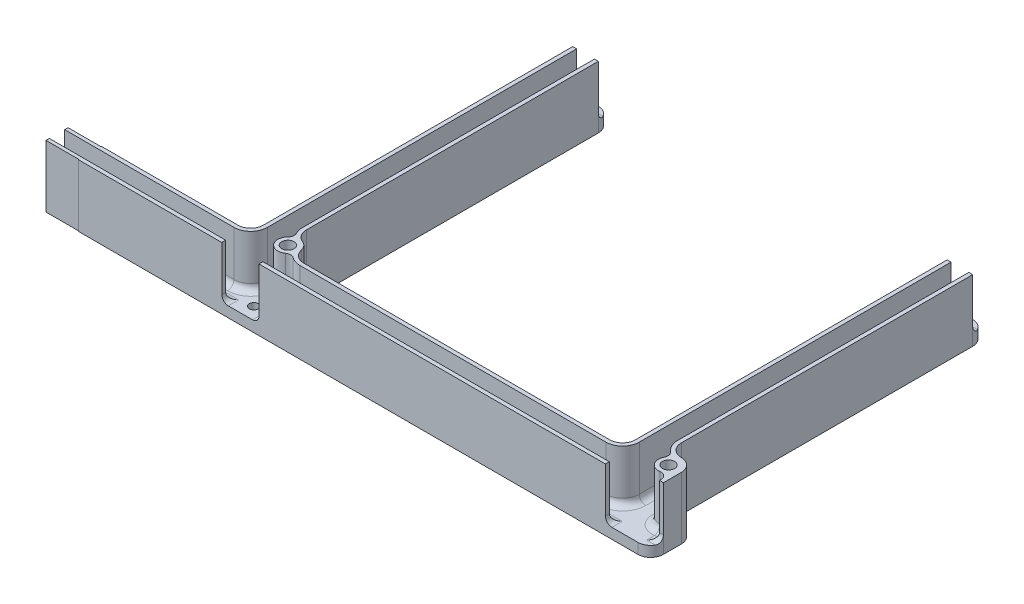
SolidWorks part; units mm, degrees
ref_plane "Front Plane" through (0, 0, 0) normal (0, 0, 1) x (1, 0, 0)
ref_plane "Top Plane" through (0, 0, 0) normal (0, 1, 0) x (1, 0, 0)
ref_plane "Right Plane" through (0, 0, 0) normal (1, 0, 0) x (0, 0, -1)
sketch "Sketch3" plane through (0, 0, 0) normal (0, 1, 0) x (1, 0, 0)
  line L0 (-138.4746, -60.844) -> (-15.34, -60.844)
  line L3 (-147.6746, -69.8669) -> (150.1404, -69.8669)
  line L6 (-152.6746, -64.8669) -> (-152.6746, 65.1331) construction
  line L10 (-157.6746, -64.8669) -> (-157.6746, 66.1101)
  line L13 (-147.6746, -69.8669) -> (-152.6746, -69.8669)
  line L20 (135.1404, -55.844) -> (135.1404, 66.1101)
  line L22 (145.1404, -47.8669) -> (145.1404, 66.1101)
  line L28 (155.1404, -64.8669) -> (155.1404, -57.8669)
  line L30 (-147.58, -49.9437) -> (-147.58, 65.1331)
  line L35 (-0.34, -49.0952) -> (-0.34, 65.1331)
  line L37 (10.4264, -60.844) -> (130.1404, -60.844)
  line L38 (-10.34, -55.844) -> (-10.34, 65.1331)
  arc A4 (150.1404, -69.8669) -> (155.1404, -64.8669) centre (150.1404, -64.8669) ccw
  arc A16 (-157.6746, -64.8669) -> (-152.6746, -69.8669) centre (-152.6746, -64.8669) ccw
  arc A23 (-147.58, 65.1331) -> (-157.6746, 66.1101) centre (-152.6746, 65.1331) ccw
  arc A39 (-0.34, 65.1331) -> (-10.34, 65.1331) centre (-5.34, 65.1331) ccw
  arc A45 (145.1404, 66.1101) -> (135.1404, 66.1101) centre (140.1404, 66.1101) ccw
  arc A46 (150.1404, -69.8669) -> (155.1404, -64.8669) centre (150.1404, -64.8669) ccw
  arc A51 (155.1404, -57.8669) -> (150.1404, -52.8669) centre (150.1404, -57.8669) ccw
  circle A59 centre (150.1404, -57.8669) radius 1.905 construction
  circle A60 centre (1.2264, -57.8669) radius 1.905 construction
  circle A61 centre (-147.6746, -57.8669) radius 1.905 construction
  arc A63 (-143.358, -56.9178) -> (-145.2842, -54.1494) centre (-147.6746, -57.8669) ccw
  arc A64 (5.543, -56.9178) -> (2.8374, -53.7513) centre (1.2264, -57.8669) ccw
  arc A65 (145.1404, -47.8669) -> (150.1404, -52.8669) centre (150.1404, -47.8669) ccw
  arc A66 (135.1404, -55.844) -> (130.1404, -60.844) centre (130.1404, -55.844) cw
  arc A67 (2.8374, -53.7513) -> (-0.34, -49.0952) centre (4.66, -49.0952) cw
  arc A74 (-10.34, -55.844) -> (-15.34, -60.844) centre (-15.34, -55.844) cw
  arc A75 (-147.58, -49.9437) -> (-145.2842, -54.1494) centre (-142.58, -49.9437) ccw
  arc A76 (5.543, -56.9178) -> (10.4264, -60.844) centre (10.4264, -55.844) ccw
  arc A77 (-143.358, -56.9178) -> (-138.4746, -60.844) centre (-138.4746, -55.844) ccw
  circle A78 centre (-147.6746, -57.8669) radius 2.105
  circle A79 centre (1.2264, -57.8669) radius 2.105
  circle A80 centre (150.1404, -57.8669) radius 2.105
  point P15 (-152.6746, 0.6216)
  point P25 (-5.4346, 0.5656)
  point P33 (140.1404, 3.1216)
  point P39 (150.1404, -61.3669)
  dimension "D1" = 5
  dimension "D2" = 5
  dimension "D5" = 5
  dimension "D6" = 5
  dimension "D3" = 5
  dimension "D4" = 130
extrude "Boss-Extrude8" add sketch "Sketch3" along normal blind 24.13 contours A77 A63 A75 L30 A23 L10 A16 L13 L3 A4 L28 A51 A65 L22 A45 L20 A66 L37 A76 A64 A67 L35 A39 L38 A74 L0 A80 A79 A78
sketch "Sketch4" plane through (0, 24.13, 0) normal (0, 1, 0) x (1, 0, 0)
  circle A3 centre (150.1404, -57.8669) radius 2.1082 construction
  circle A4 centre (1.2394, -57.8669) radius 2.0955 construction
  circle A5 centre (-147.6746, -57.8669) radius 2.0955 construction
  circle A6 centre (-147.6746, -57.8669) radius 2.2955
  circle A7 centre (1.2394, -57.8669) radius 2.2955
  circle A8 centre (150.1404, -57.8669) radius 2.3082
  dimension "D1" = 0.2
extrude "Cut-Extrude1" cut sketch "Sketch4" against normal up to next
sketch "Sketch6" plane through (0, 0, 0) normal (0, -1, 0) x (1, 0, 0)
  line L10 (-138.4746, 60.844) -> (-15.34, 60.844)
  line L11 (-10.34, 55.844) -> (-10.34, -65.1331)
  line L12 (-0.34, -65.1331) -> (-0.34, 49.0952)
  line L13 (10.4264, 60.844) -> (130.1404, 60.844)
  line L14 (135.1404, 55.844) -> (135.1404, -66.1101)
  line L15 (145.1404, -66.1101) -> (145.1404, 47.8669)
  line L16 (155.1404, 57.8669) -> (155.1404, 64.8669)
  line L17 (150.1404, 69.8669) -> (-152.6746, 69.8669)
  line L18 (-157.6746, 64.8669) -> (-157.6746, -66.1101)
  line L19 (-147.58, -65.1331) -> (-147.58, 49.9437)
  line L20 (-138.4746, 60.844) -> (-15.34, 60.844)
  line L21 (-10.34, 55.844) -> (-10.34, -65.1331)
  line L22 (-0.34, -65.1331) -> (-0.34, 49.0952)
  line L23 (10.4264, 60.844) -> (130.1404, 60.844)
  line L24 (135.1404, 55.844) -> (135.1404, -66.1101)
  line L25 (145.1404, -66.1101) -> (145.1404, 47.8669)
  line L26 (155.1404, 57.8669) -> (155.1404, 64.8669)
  line L27 (150.1404, 69.8669) -> (-152.6746, 69.8669)
  line L28 (-157.6746, 64.8669) -> (-157.6746, -66.1101)
  line L29 (-147.58, -65.1331) -> (-147.58, 49.9437)
  circle A0 centre (-147.6746, 57.8669) radius 2.2955 construction
  circle A1 centre (1.2394, 57.8669) radius 2.2955 construction
  circle A2 centre (150.1404, 57.8669) radius 2.3082 construction
  circle A3 centre (-147.6746, 57.8669) radius 2.2955
  circle A4 centre (1.2394, 57.8669) radius 2.2955
  circle A5 centre (150.1404, 57.8669) radius 2.3082
  arc A15 (-138.4746, 60.844) -> (-143.358, 56.9178) centre (-138.4746, 55.844) ccw
  arc A16 (-10.34, 55.844) -> (-15.34, 60.844) centre (-15.34, 55.844) ccw
  arc A17 (-10.34, -65.1331) -> (-0.34, -65.1331) centre (-5.34, -65.1331) ccw
  arc A18 (2.8374, 53.7513) -> (-0.34, 49.0952) centre (4.66, 49.0952) ccw
  arc A19 (2.8374, 53.7513) -> (5.543, 56.9178) centre (1.2264, 57.8669) ccw
  arc A20 (10.4264, 60.844) -> (5.543, 56.9178) centre (10.4264, 55.844) ccw
  arc A21 (135.1404, 55.844) -> (130.1404, 60.844) centre (130.1404, 55.844) ccw
  arc A22 (135.1404, -66.1101) -> (145.1404, -66.1101) centre (140.1404, -66.1101) ccw
  arc A23 (150.1404, 52.8669) -> (145.1404, 47.8669) centre (150.1404, 47.8669) ccw
  arc A24 (150.1404, 52.8669) -> (155.1404, 57.8669) centre (150.1404, 57.8669) ccw
  arc A25 (155.1404, 64.8669) -> (150.1404, 69.8669) centre (150.1404, 64.8669) ccw
  arc A26 (-152.6746, 69.8669) -> (-157.6746, 64.8669) centre (-152.6746, 64.8669) ccw
  arc A27 (-157.6746, -66.1101) -> (-147.58, -65.1331) centre (-152.6746, -65.1331) ccw
  arc A28 (-145.2842, 54.1494) -> (-147.58, 49.9437) centre (-142.58, 49.9437) ccw
  arc A29 (-145.2842, 54.1494) -> (-143.358, 56.9178) centre (-147.6746, 57.8669) ccw
  arc A30 (-138.4746, 60.844) -> (-143.358, 56.9178) centre (-138.4746, 55.844) ccw
  arc A31 (-10.34, 55.844) -> (-15.34, 60.844) centre (-15.34, 55.844) ccw
  arc A32 (-10.34, -65.1331) -> (-0.34, -65.1331) centre (-5.34, -65.1331) ccw
  arc A33 (2.8374, 53.7513) -> (-0.34, 49.0952) centre (4.66, 49.0952) ccw
  arc A34 (2.8374, 53.7513) -> (5.543, 56.9178) centre (1.2264, 57.8669) ccw
  arc A35 (10.4264, 60.844) -> (5.543, 56.9178) centre (10.4264, 55.844) ccw
  arc A36 (135.1404, 55.844) -> (130.1404, 60.844) centre (130.1404, 55.844) ccw
  arc A37 (135.1404, -66.1101) -> (145.1404, -66.1101) centre (140.1404, -66.1101) ccw
  arc A38 (150.1404, 52.8669) -> (145.1404, 47.8669) centre (150.1404, 47.8669) ccw
  arc A39 (150.1404, 52.8669) -> (155.1404, 57.8669) centre (150.1404, 57.8669) ccw
  arc A40 (155.1404, 64.8669) -> (150.1404, 69.8669) centre (150.1404, 64.8669) ccw
  arc A41 (-152.6746, 69.8669) -> (-157.6746, 64.8669) centre (-152.6746, 64.8669) ccw
  arc A42 (-157.6746, -66.1101) -> (-147.58, -65.1331) centre (-152.6746, -65.1331) ccw
  arc A43 (-145.2842, 54.1494) -> (-147.58, 49.9437) centre (-142.58, 49.9437) ccw
  arc A44 (-145.2842, 54.1494) -> (-143.358, 56.9178) centre (-147.6746, 57.8669) ccw
  dimension "D1" = 0
extrude "Boss-Extrude10" add sketch "Sketch6" along normal up to surface (0.1359 mm away)
ref_plane "Plane1" through (140.1404, -0.1359, -71.1101) normal (0, 0, -1) x (-1, 0, 0)
sketch "Sketch7" plane through (140.1404, -0.1359, -71.1101) normal (0, 0, -1) x (-1, 0, 0)
  line L0 (3.175, 24.2659) -> (-3.175, 24.2659)
  line L1 (3.175, 24.2659) -> (3.175, 13.6657)
  line L2 (-3.175, 24.2659) -> (-3.175, 13.6657)
  line L3 (0, 0) -> (0, 4.7094) construction
  line L4 (2.8207, 11.8017) -> (0, 4.6507)
  line L5 (-2.8207, 11.8017) -> (0, 4.6507)
  arc A3 (-3.175, 13.6657) -> (-2.8207, 11.8017) centre (1.905, 13.6657) ccw
  arc A4 (3.175, 13.6657) -> (2.8207, 11.8017) centre (-1.905, 13.6657) cw
  spline S0 degree 2 poles (0, 4.7094) (-0.0001, 4.6801) (0, 4.6507) knots 0.992285 0.992285 0.992285 1 1 1
  spline S1 degree 2 poles (0, 4.7094) (0.0001, 4.6801) (0, 4.6507) knots 0.992284 0.992284 0.992284 1 1 1
  point P6 (0, 18.4829)
  dimension "D1" = 5.08
sketch "Sketch9" plane through (0, -0.1359, 0) normal (0, -1, 0) x (1, 0, 0)
  line L0 (140.1404, -71.1101) -> (140.1404, 59.7869)
  line L2 (145.2204, 64.8669) -> (155.1404, 64.8669)
  arc A0 (135.1404, -66.1101) -> (145.1404, -66.1101) centre (140.1404, -66.1101) ccw construction
  arc A1 (145.2204, 64.8669) -> (140.1404, 59.7869) centre (145.2204, 59.7869) ccw
  point P0 (140.1404, -71.1101)
  dimension "D1" = 5.08
sketch "Sketch10" plane through (140.1404, -0.1359, -71.1101) normal (0, 0, -1) x (-1, 0, 0)
  line L0 (0, 0) -> (145.4804, 0) construction
  line L1 (72.7402, 0) -> (72.7402, 27.3401) construction
  line L4 (140.4804, 24.2659) -> (140.4804, 0)
  line L5 (140.4804, 0) -> (150.4804, 0)
  line L6 (150.4804, 0) -> (150.4804, 24.2659)
  line L7 (150.4804, 24.2659) -> (140.4804, 24.2659)
  line L9 (140.4804, 0) -> (145.4804, 0) construction
  line L19 (3.175, 24.2659) -> (-3.175, 24.2659) construction
  line L20 (-3.175, 24.2659) -> (-3.175, 13.6657) construction
  line L21 (3.175, 24.2659) -> (3.175, 13.6657) construction
  line L22 (2.8207, 11.8017) -> (0, 4.6507) construction
  line L23 (-2.8207, 11.8017) -> (0, 4.6507) construction
  line L24 (3.175, 24.2659) -> (-3.175, 24.2659) construction
  line L25 (-3.175, 24.2659) -> (-3.175, 13.6657) construction
  line L26 (3.175, 24.2659) -> (3.175, 13.6657) construction
  line L27 (2.8207, 11.8017) -> (0, 4.6507) construction
  line L28 (-2.8207, 11.8017) -> (0, 4.6507) construction
  line L29 (148.3011, 11.8017) -> (145.4804, 4.6507)
  line L30 (142.6598, 11.8017) -> (145.4804, 4.6507)
  line L31 (142.3054, 24.2659) -> (142.3054, 13.6657)
  line L32 (148.6554, 24.2659) -> (148.6554, 13.6657)
  line L33 (142.3054, 24.2659) -> (148.6554, 24.2659)
  arc A6 (-3.175, 13.6657) -> (-2.8207, 11.8017) centre (1.905, 13.6657) ccw construction
  arc A7 (2.8207, 11.8017) -> (3.175, 13.6657) centre (-1.905, 13.6657) ccw construction
  arc A8 (-3.175, 13.6657) -> (-2.8207, 11.8017) centre (1.905, 13.6657) ccw construction
  arc A9 (2.8207, 11.8017) -> (3.175, 13.6657) centre (-1.905, 13.6657) ccw construction
  arc A10 (142.6598, 11.8017) -> (142.3054, 13.6657) centre (147.3854, 13.6657) cw
  arc A11 (148.6554, 13.6657) -> (148.3011, 11.8017) centre (143.5754, 13.6657) cw
  dimension "D1" = 0
sketch "Sketch15" plane through (0, -0.1359, 0) normal (0, -1, 0) x (1, 0, 0)
  line L0 (-5.34, -71.1101) -> (-5.34, 69.8669)
  line L1 (150.1404, 69.8669) -> (-152.6746, 69.8669) construction
  point P0 (-5.34, -71.1101)
sketch "Sketch14" plane through (140.1404, -0.1359, -71.1101) normal (0, 0, -1) x (-1, 0, 0)
  line L0 (142.3054, 24.2659) -> (148.6554, 24.2659) construction
  line L1 (148.6554, 24.2659) -> (148.6554, 13.6657) construction
  line L2 (142.3054, 24.2659) -> (142.3054, 13.6657) construction
  line L3 (148.3011, 11.8017) -> (145.4804, 4.6507) construction
  line L4 (142.6598, 11.8017) -> (145.4804, 4.6507) construction
  line L5 (142.3054, 24.2659) -> (148.6554, 24.2659) construction
  line L6 (148.6554, 24.2659) -> (148.6554, 13.6657) construction
  line L7 (142.3054, 24.2659) -> (142.3054, 13.6657) construction
  line L8 (148.3011, 11.8017) -> (145.4804, 4.6507) construction
  line L9 (142.6598, 11.8017) -> (145.4804, 4.6507) construction
  line L10 (145.4804, 0) -> (292.7677, 0) construction
  line L11 (219.1241, 0) -> (219.1241, 22.4525) construction
  line L12 (295.5884, 11.8017) -> (292.7677, 4.6507)
  line L13 (289.9471, 11.8017) -> (292.7677, 4.6507)
  line L14 (287.7204, 24.2659) -> (287.7204, 0)
  line L15 (287.7204, 0) -> (297.815, 0)
  line L16 (297.815, 0) -> (297.815, 24.2659)
  line L17 (297.815, 24.2659) -> (287.7204, 24.2659)
  line L18 (287.7204, 24.2659) -> (287.7204, 0) construction
  line L19 (287.7204, 0) -> (297.815, 0) construction
  line L20 (297.815, 0) -> (297.815, 24.2659) construction
  line L21 (297.815, 24.2659) -> (287.7204, 24.2659) construction
  line L22 (295.9427, 24.2659) -> (295.9427, 13.6657)
  line L23 (289.5927, 24.2659) -> (289.5927, 13.6657)
  line L24 (295.9427, 24.2659) -> (289.5927, 24.2659)
  arc A0 (142.3054, 13.6657) -> (142.6598, 11.8017) centre (147.3854, 13.6657) ccw construction
  arc A1 (148.3011, 11.8017) -> (148.6554, 13.6657) centre (143.5754, 13.6657) ccw construction
  arc A2 (142.3054, 13.6657) -> (142.6598, 11.8017) centre (147.3854, 13.6657) ccw construction
  arc A3 (148.3011, 11.8017) -> (148.6554, 13.6657) centre (143.5754, 13.6657) ccw construction
  arc A4 (289.9471, 11.8017) -> (289.5927, 13.6657) centre (294.6727, 13.6657) cw
  arc A5 (295.9427, 13.6657) -> (295.5884, 11.8017) centre (290.8627, 13.6657) cw
  dimension "D1" = 0
sketch "Sketch16" plane through (0, -0.1359, 0) normal (0, -1, 0) x (1, 0, 0)
  line L0 (-152.6273, -71.1101) -> (-152.6273, 59.7869)
  line L1 (-157.7073, 64.8669) -> (-168.8507, 64.8669)
  arc A0 (-152.6273, 59.7869) -> (-157.7073, 64.8669) centre (-157.7073, 59.7869) ccw
  point P0 (-152.6273, -71.1101)
  dimension "D1" = 5.08
sweep "Cut-Sweep3" [suppressed] cut profiles "Sketch7" path "Sketch9"
sweep "Cut-Sweep4" [suppressed] cut profiles "Sketch10" path "Sketch15"
sweep "Cut-Sweep5" [suppressed] cut profiles "Sketch14" path "Sketch16"
sketch "Sketch17" [suppressed] plane through (155.1404, 0, 0) normal (1, 0, 0) x (0, 0, -1)
  line L1 (-68.0419, 24.13) -> (-68.0419, 13.5298) construction
  line L2 (-64.8669, 4.5148) -> (-67.6876, 11.6658) construction
  line L3 (-62.0463, 11.6658) -> (-64.8669, 4.5148) construction
  line L4 (-61.6919, 24.13) -> (-61.6919, 13.5298) construction
  line L5 (-68.0419, 24.13) -> (-68.0419, 13.5298)
  line L6 (-64.8669, 4.5148) -> (-67.6876, 11.6658)
  line L7 (-62.0463, 11.6658) -> (-64.8669, 4.5148)
  line L8 (-61.6919, 24.13) -> (-61.6919, 13.5298)
  line L9 (-61.6919, 24.13) -> (-68.0419, 24.13)
  arc A1 (-68.0419, 13.5298) -> (-67.6876, 11.6658) centre (-62.9619, 13.5298) ccw construction
  arc A2 (-62.0463, 11.6658) -> (-61.6919, 13.5298) centre (-66.7719, 13.5298) ccw construction
  arc A3 (-68.0419, 13.5298) -> (-67.6876, 11.6658) centre (-62.9619, 13.5298) ccw
  arc A4 (-62.0463, 11.6658) -> (-61.6919, 13.5298) centre (-66.7719, 13.5298) ccw
sketch "Sketch18" [suppressed] plane through (0, -0.1359, 0) normal (0, -1, 0) x (1, 0, 0)
  line L0 (155.1404, 64.8669) -> (-168.7072, 64.8669)
  point P0 (155.1404, 64.8669)
sweep "Cut-Sweep6" [suppressed] cut profiles "Sketch17" path "Sketch18"
sketch "Sketch19" plane through (0, -0.1359, 0) normal (0, -1, 0) x (1, 0, 0)
  line L0 (-152.744, -65.1847) -> (-152.744, 49.8921) construction
  line L1 (-155.284, -65.1847) -> (-155.284, 49.8921)
  line L2 (-150.204, -65.1847) -> (-150.204, 49.8921)
  line L3 (-152.744, 64.8153) -> (-10.4094, 64.8153) construction
  line L4 (-152.744, 67.3553) -> (-10.4094, 67.3553)
  line L5 (-152.744, 62.2753) -> (-10.4094, 62.2753)
  line L6 (-157.744, 64.8153) -> (-157.744, -66.1618)
  line L7 (-147.6494, -65.1847) -> (-147.6494, 49.8921)
  line L8 (-138.544, 60.7924) -> (-15.4094, 60.7924)
  line L9 (-10.4094, 55.7924) -> (-10.4094, -65.1847)
  line L10 (-5.4094, -65.1847) -> (-5.4094, 55.7924) construction
  line L11 (-7.9494, -65.1847) -> (-7.9494, 55.7924)
  line L12 (-2.8694, -65.1847) -> (-2.8694, 55.7924)
  line L13 (140.0816, -66.4288) -> (140.0816, 55.5253) construction
  line L14 (137.5416, -66.4288) -> (137.5416, 55.5253)
  line L15 (142.6216, -66.4288) -> (142.6216, 55.5253)
  line L16 (149.2437, 65.494) -> (-0.8967, 65.494) construction
  line L17 (149.2437, 62.954) -> (-0.8967, 62.954)
  line L18 (149.2437, 68.034) -> (-0.8967, 68.034)
  arc A0 (-155.284, -65.1847) -> (-150.204, -65.1847) centre (-152.744, -65.1847) ccw
  arc A1 (-150.204, 49.8921) -> (-155.284, 49.8921) centre (-152.744, 49.8921) ccw
  arc A2 (-152.744, 67.3553) -> (-152.744, 62.2753) centre (-152.744, 64.8153) ccw
  arc A3 (-10.4094, 62.2753) -> (-10.4094, 67.3553) centre (-10.4094, 64.8153) ccw
  arc A4 (-7.9494, -65.1847) -> (-2.8694, -65.1847) centre (-5.4094, -65.1847) ccw
  arc A5 (-2.8694, 55.7924) -> (-7.9494, 55.7924) centre (-5.4094, 55.7924) ccw
  arc A6 (-10.4094, -65.1847) -> (-5.4094, -70.1847) centre (-5.4094, -65.1847) ccw
  arc A7 (-152.744, 69.8153) -> (-157.744, 64.8153) centre (-152.744, 64.8153) ccw
  arc A8 (-157.744, -66.1618) -> (-147.6494, -65.1847) centre (-152.744, -65.1847) ccw
  arc A9 (-145.3536, 54.0977) -> (-147.6494, 49.8921) centre (-142.6494, 49.8921) ccw
  arc A10 (-145.3536, 54.0977) -> (-143.4273, 56.8661) centre (-147.744, 57.8153) ccw
  arc A11 (-138.544, 60.7924) -> (-143.4273, 56.8661) centre (-138.544, 55.7924) ccw
  arc A12 (-10.4094, 55.7924) -> (-15.4094, 60.7924) centre (-15.4094, 55.7924) ccw
  arc A13 (137.5416, -66.4288) -> (142.6216, -66.4288) centre (140.0816, -66.4288) ccw
  arc A14 (142.6216, 55.5253) -> (137.5416, 55.5253) centre (140.0816, 55.5253) ccw
  arc A15 (149.2437, 62.954) -> (149.2437, 68.034) centre (149.2437, 65.494) ccw
  arc A16 (-0.8967, 68.034) -> (-0.8967, 62.954) centre (-0.8967, 65.494) ccw
  point P0 (-152.744, -7.6463)
  point P22 (-81.5767, 64.8153)
  point P31 (-5.4094, -4.6962)
  point P39 (140.0816, -5.4517)
  point P46 (74.1735, 65.494)
  dimension "D1" = 2.54
  dimension "D2" = 2.54
  dimension "D3" = 2.54
  dimension "D4" = 2.54
  dimension "D5" = 2.54
extrude "Cut-Extrude2" cut sketch "Sketch19" against normal blind 1.27 contours L2 A1 L1 A0 | L5 A3 L4 A2 | L12 A5 L11 A4 | L18 A16 L17 A15 | L15 A14 L14 A13
sketch "Sketch21" plane through (0, -0.1359, 0) normal (0, -1, 0) x (1, 0, 0)
  circle A3 centre (-147.6746, 57.8669) radius 2.1082
  circle A4 centre (1.2264, 57.8669) radius 2.1082
  circle A5 centre (150.1404, 57.8669) radius 2.1082
  circle A6 centre (-147.6746, 57.8669) radius 2.4082
  circle A7 centre (1.2264, 57.8669) radius 2.4082
  circle A8 centre (150.1404, 57.8669) radius 2.4082
  dimension "D1" = 0.3
extrude "Cut-Extrude3" cut sketch "Sketch21" against normal through all contours A5 M22 | A7 M23 | A4 M23 | A8 M22 | A3 M24 | A6 M24
sketch "Sketch22" plane through (0, -0.1359, 0) normal (0, -1, 0) x (1, 0, 0)
  line L0 (137.5416, -66.4288) -> (137.5416, 55.5253) construction
  line L1 (142.6216, -66.4288) -> (142.6216, 55.5253) construction
  line L2 (149.2437, 62.954) -> (-0.8967, 62.954) construction
  line L3 (149.2437, 68.034) -> (-0.8967, 68.034) construction
  line L4 (-2.8694, -65.1847) -> (-2.8694, 55.7924) construction
  line L5 (-7.9494, -65.1847) -> (-7.9494, 55.7924) construction
  line L6 (-155.284, -65.1847) -> (-155.284, 49.8921) construction
  line L7 (-150.204, -65.1847) -> (-150.204, 49.8921) construction
  line L8 (-152.744, 62.2753) -> (-10.4094, 62.2753) construction
  line L9 (-152.744, 67.3553) -> (-10.4094, 67.3553) construction
  line L10 (-138.4746, 60.844) -> (-15.34, 60.844)
  line L11 (-10.34, 55.844) -> (-10.34, -65.1331)
  line L12 (-0.34, -65.1331) -> (-0.34, 49.0952)
  line L13 (10.4264, 60.844) -> (130.1404, 60.844)
  line L14 (135.1404, 55.844) -> (135.1404, -66.1101)
  line L15 (145.1404, -66.1101) -> (145.1404, 47.8669)
  line L16 (155.1404, 57.8669) -> (155.1404, 64.8669)
  line L17 (150.1404, 69.8669) -> (-152.6746, 69.8669)
  line L18 (-157.6746, 64.8669) -> (-157.6746, -66.1101)
  line L19 (-147.58, -65.1331) -> (-147.58, 49.9437)
  line L20 (-138.4746, 60.844) -> (-15.34, 60.844)
  line L21 (-10.34, 55.844) -> (-10.34, -65.1331)
  line L22 (-0.34, -65.1331) -> (-0.34, 49.0952)
  line L23 (10.4264, 60.844) -> (130.1404, 60.844)
  line L24 (135.1404, 55.844) -> (135.1404, -66.1101)
  line L25 (145.1404, -66.1101) -> (145.1404, 47.8669)
  line L26 (155.1404, 57.8669) -> (155.1404, 64.8669)
  line L27 (150.1404, 69.8669) -> (-152.6746, 69.8669)
  line L28 (-157.6746, 64.8669) -> (-157.6746, -66.1101)
  line L29 (-147.58, -65.1331) -> (-147.58, 49.9437)
  line L30 (137.5416, -66.4288) -> (137.5416, 55.5253)
  line L31 (142.6216, -66.4288) -> (142.6216, 55.5253)
  line L32 (149.2437, 62.954) -> (-0.8967, 62.954)
  line L33 (149.2437, 68.034) -> (-0.8967, 68.034)
  line L34 (-2.8694, -65.1847) -> (-2.8694, 55.7924)
  line L35 (-7.9494, -65.1847) -> (-7.9494, 55.7924)
  line L36 (-155.284, -65.1847) -> (-155.284, 49.8921)
  line L37 (-150.204, -65.1847) -> (-150.204, 49.8921)
  line L38 (-152.744, 62.2753) -> (-10.4094, 62.2753)
  line L39 (-152.744, 67.3553) -> (-10.4094, 67.3553)
  arc A0 (137.5416, -66.4288) -> (142.6216, -66.4288) centre (140.0816, -66.4288) ccw construction
  arc A1 (142.6216, 55.5253) -> (137.5416, 55.5253) centre (140.0816, 55.5253) ccw construction
  arc A2 (149.2437, 62.954) -> (149.2437, 68.034) centre (149.2437, 65.494) ccw construction
  arc A3 (-0.8967, 68.034) -> (-0.8967, 62.954) centre (-0.8967, 65.494) ccw construction
  arc A4 (-10.4094, 62.2753) -> (-10.4094, 67.3553) centre (-10.4094, 64.8153) ccw construction
  arc A5 (-2.8694, 55.7924) -> (-7.9494, 55.7924) centre (-5.4094, 55.7924) ccw construction
  arc A6 (-7.9494, -65.1847) -> (-2.8694, -65.1847) centre (-5.4094, -65.1847) ccw construction
  arc A7 (-155.284, -65.1847) -> (-150.204, -65.1847) centre (-152.744, -65.1847) ccw construction
  arc A8 (-150.204, 49.8921) -> (-155.284, 49.8921) centre (-152.744, 49.8921) ccw construction
  arc A9 (-152.744, 67.3553) -> (-152.744, 62.2753) centre (-152.744, 64.8153) ccw construction
  arc A10 (137.5416, -66.4288) -> (142.6216, -66.4288) centre (140.0816, -66.4288) ccw
  arc A11 (142.6216, 55.5253) -> (137.5416, 55.5253) centre (140.0816, 55.5253) ccw
  arc A12 (149.2437, 62.954) -> (149.2437, 68.034) centre (149.2437, 65.494) ccw
  arc A13 (-0.8967, 68.034) -> (-0.8967, 62.954) centre (-0.8967, 65.494) ccw
  arc A14 (-10.4094, 62.2753) -> (-10.4094, 67.3553) centre (-10.4094, 64.8153) ccw
  arc A15 (-145.2842, 54.1494) -> (-143.358, 56.9178) centre (-147.6746, 57.8669) ccw
  arc A16 (-138.4746, 60.844) -> (-143.358, 56.9178) centre (-138.4746, 55.844) ccw
  arc A17 (-10.34, 55.844) -> (-15.34, 60.844) centre (-15.34, 55.844) ccw
  arc A18 (-10.34, -65.1331) -> (-0.34, -65.1331) centre (-5.34, -65.1331) ccw
  arc A19 (2.8374, 53.7513) -> (-0.34, 49.0952) centre (4.66, 49.0952) ccw
  arc A20 (2.8374, 53.7513) -> (5.543, 56.9178) centre (1.2264, 57.8669) ccw
  arc A21 (10.4264, 60.844) -> (5.543, 56.9178) centre (10.4264, 55.844) ccw
  arc A22 (135.1404, 55.844) -> (130.1404, 60.844) centre (130.1404, 55.844) ccw
  arc A23 (135.1404, -66.1101) -> (145.1404, -66.1101) centre (140.1404, -66.1101) ccw
  arc A24 (150.1404, 52.8669) -> (145.1404, 47.8669) centre (150.1404, 47.8669) ccw
  arc A25 (150.1404, 52.8669) -> (155.1404, 57.8669) centre (150.1404, 57.8669) ccw
  arc A26 (155.1404, 64.8669) -> (150.1404, 69.8669) centre (150.1404, 64.8669) ccw
  arc A27 (-152.6746, 69.8669) -> (-157.6746, 64.8669) centre (-152.6746, 64.8669) ccw
  arc A28 (-157.6746, -66.1101) -> (-147.58, -65.1331) centre (-152.6746, -65.1331) ccw
  arc A29 (-145.2842, 54.1494) -> (-147.58, 49.9437) centre (-142.58, 49.9437) ccw
  arc A30 (-145.2842, 54.1494) -> (-143.358, 56.9178) centre (-147.6746, 57.8669) ccw
  arc A31 (-138.4746, 60.844) -> (-143.358, 56.9178) centre (-138.4746, 55.844) ccw
  arc A32 (-10.34, 55.844) -> (-15.34, 60.844) centre (-15.34, 55.844) ccw
  arc A33 (-10.34, -65.1331) -> (-0.34, -65.1331) centre (-5.34, -65.1331) ccw
  arc A34 (2.8374, 53.7513) -> (-0.34, 49.0952) centre (4.66, 49.0952) ccw
  arc A35 (2.8374, 53.7513) -> (5.543, 56.9178) centre (1.2264, 57.8669) ccw
  arc A36 (10.4264, 60.844) -> (5.543, 56.9178) centre (10.4264, 55.844) ccw
  arc A37 (135.1404, 55.844) -> (130.1404, 60.844) centre (130.1404, 55.844) ccw
  arc A38 (135.1404, -66.1101) -> (145.1404, -66.1101) centre (140.1404, -66.1101) ccw
  arc A39 (150.1404, 52.8669) -> (145.1404, 47.8669) centre (150.1404, 47.8669) ccw
  arc A40 (150.1404, 52.8669) -> (155.1404, 57.8669) centre (150.1404, 57.8669) ccw
  arc A41 (155.1404, 64.8669) -> (150.1404, 69.8669) centre (150.1404, 64.8669) ccw
  arc A42 (-152.6746, 69.8669) -> (-157.6746, 64.8669) centre (-152.6746, 64.8669) ccw
  arc A43 (-157.6746, -66.1101) -> (-147.58, -65.1331) centre (-152.6746, -65.1331) ccw
  arc A44 (-145.2842, 54.1494) -> (-147.58, 49.9437) centre (-142.58, 49.9437) ccw
  arc A45 (-2.8694, 55.7924) -> (-7.9494, 55.7924) centre (-5.4094, 55.7924) ccw
  arc A46 (-7.9494, -65.1847) -> (-2.8694, -65.1847) centre (-5.4094, -65.1847) ccw
  arc A47 (-155.284, -65.1847) -> (-150.204, -65.1847) centre (-152.744, -65.1847) ccw
  arc A48 (-150.204, 49.8921) -> (-155.284, 49.8921) centre (-152.744, 49.8921) ccw
  arc A49 (-152.744, 67.3553) -> (-152.744, 62.2753) centre (-152.744, 64.8153) ccw
  dimension "D1" = 0
sketch "Sketch23" plane through (0, -0.1359, 0) normal (0, -1, 0) x (1, 0, 0)
  line L10 (-138.4746, 60.844) -> (-15.34, 60.844)
  line L11 (-10.34, 55.844) -> (-10.34, -65.1331)
  line L12 (-0.34, -65.1331) -> (-0.34, 49.0952)
  line L13 (10.4264, 60.844) -> (130.1404, 60.844)
  line L14 (135.1404, 55.844) -> (135.1404, -66.1101)
  line L15 (145.1404, -66.1101) -> (145.1404, 47.8669)
  line L16 (155.1404, 57.8669) -> (155.1404, 64.8669)
  line L17 (150.1404, 69.8669) -> (-152.6746, 69.8669)
  line L18 (-157.6746, 64.8669) -> (-157.6746, -66.1101)
  line L19 (-147.58, -65.1331) -> (-147.58, 49.9437)
  line L20 (-138.4746, 60.844) -> (-15.34, 60.844)
  line L21 (-10.34, 55.844) -> (-10.34, -65.1331)
  line L22 (-0.34, -65.1331) -> (-0.34, 49.0952)
  line L23 (10.4264, 60.844) -> (130.1404, 60.844)
  line L24 (135.1404, 55.844) -> (135.1404, -66.1101)
  line L25 (145.1404, -66.1101) -> (145.1404, 47.8669)
  line L26 (155.1404, 57.8669) -> (155.1404, 64.8669)
  line L27 (150.1404, 69.8669) -> (-152.6746, 69.8669)
  line L28 (-157.6746, 64.8669) -> (-157.6746, -66.1101)
  line L29 (-147.58, -65.1331) -> (-147.58, 49.9437)
  arc A15 (-145.2842, 54.1494) -> (-143.358, 56.9178) centre (-147.6746, 57.8669) ccw
  arc A16 (-138.4746, 60.844) -> (-143.358, 56.9178) centre (-138.4746, 55.844) ccw
  arc A17 (-10.34, 55.844) -> (-15.34, 60.844) centre (-15.34, 55.844) ccw
  arc A18 (-10.34, -65.1331) -> (-0.34, -65.1331) centre (-5.34, -65.1331) ccw
  arc A19 (2.8374, 53.7513) -> (-0.34, 49.0952) centre (4.66, 49.0952) ccw
  arc A20 (2.8374, 53.7513) -> (5.543, 56.9178) centre (1.2264, 57.8669) ccw
  arc A21 (10.4264, 60.844) -> (5.543, 56.9178) centre (10.4264, 55.844) ccw
  arc A22 (135.1404, 55.844) -> (130.1404, 60.844) centre (130.1404, 55.844) ccw
  arc A23 (135.1404, -66.1101) -> (145.1404, -66.1101) centre (140.1404, -66.1101) ccw
  arc A24 (150.1404, 52.8669) -> (145.1404, 47.8669) centre (150.1404, 47.8669) ccw
  arc A25 (150.1404, 52.8669) -> (155.1404, 57.8669) centre (150.1404, 57.8669) ccw
  arc A26 (155.1404, 64.8669) -> (150.1404, 69.8669) centre (150.1404, 64.8669) ccw
  arc A27 (-152.6746, 69.8669) -> (-157.6746, 64.8669) centre (-152.6746, 64.8669) ccw
  arc A28 (-157.6746, -66.1101) -> (-147.58, -65.1331) centre (-152.6746, -65.1331) ccw
  arc A29 (-145.2842, 54.1494) -> (-147.58, 49.9437) centre (-142.58, 49.9437) ccw
  arc A30 (-145.2842, 54.1494) -> (-143.358, 56.9178) centre (-147.6746, 57.8669) ccw
  arc A31 (-138.4746, 60.844) -> (-143.358, 56.9178) centre (-138.4746, 55.844) ccw
  arc A32 (-10.34, 55.844) -> (-15.34, 60.844) centre (-15.34, 55.844) ccw
  arc A33 (-10.34, -65.1331) -> (-0.34, -65.1331) centre (-5.34, -65.1331) ccw
  arc A34 (2.8374, 53.7513) -> (-0.34, 49.0952) centre (4.66, 49.0952) ccw
  arc A35 (2.8374, 53.7513) -> (5.543, 56.9178) centre (1.2264, 57.8669) ccw
  arc A36 (10.4264, 60.844) -> (5.543, 56.9178) centre (10.4264, 55.844) ccw
  arc A37 (135.1404, 55.844) -> (130.1404, 60.844) centre (130.1404, 55.844) ccw
  arc A38 (135.1404, -66.1101) -> (145.1404, -66.1101) centre (140.1404, -66.1101) ccw
  arc A39 (150.1404, 52.8669) -> (145.1404, 47.8669) centre (150.1404, 47.8669) ccw
  arc A40 (150.1404, 52.8669) -> (155.1404, 57.8669) centre (150.1404, 57.8669) ccw
  arc A41 (155.1404, 64.8669) -> (150.1404, 69.8669) centre (150.1404, 64.8669) ccw
  arc A42 (-152.6746, 69.8669) -> (-157.6746, 64.8669) centre (-152.6746, 64.8669) ccw
  arc A43 (-157.6746, -66.1101) -> (-147.58, -65.1331) centre (-152.6746, -65.1331) ccw
  arc A44 (-145.2842, 54.1494) -> (-147.58, 49.9437) centre (-142.58, 49.9437) ccw
  dimension "D1" = 0
extrude "Cut-Extrude4" cut sketch "Sketch23" against normal blind 1.27
sketch "Sketch24" plane through (0, 1.1341, 0) normal (0, -1, 0) x (1, 0, 0)
  line L0 (137.5416, -66.4288) -> (137.5416, 55.5253) construction
  line L1 (142.6216, -66.4288) -> (142.6216, 55.5253) construction
  line L2 (149.2437, 62.954) -> (-0.8967, 62.954) construction
  line L3 (149.2437, 68.034) -> (-0.8967, 68.034) construction
  line L4 (-7.9494, -65.1847) -> (-7.9494, 55.7924) construction
  line L5 (-2.8694, -65.1847) -> (-2.8694, 55.7924) construction
  line L6 (-155.284, -65.1847) -> (-155.284, 49.8921) construction
  line L7 (-150.204, -65.1847) -> (-150.204, 49.8921) construction
  line L8 (-152.744, 67.3553) -> (-10.4094, 67.3553) construction
  line L9 (-152.744, 62.2753) -> (-10.4094, 62.2753) construction
  line L10 (137.5416, -66.4288) -> (137.5416, 55.5253)
  line L11 (142.6216, -66.4288) -> (142.6216, 55.5253)
  line L12 (149.2437, 62.954) -> (-0.8967, 62.954)
  line L13 (149.2437, 68.034) -> (-0.8967, 68.034)
  line L14 (-7.9494, -65.1847) -> (-7.9494, 55.7924)
  line L15 (-2.8694, -65.1847) -> (-2.8694, 55.7924)
  line L16 (-155.284, -65.1847) -> (-155.284, 49.8921)
  line L17 (-150.204, -65.1847) -> (-150.204, 49.8921)
  line L18 (-152.744, 67.3553) -> (-10.4094, 67.3553)
  line L19 (-152.744, 62.2753) -> (-10.4094, 62.2753)
  arc A0 (142.6216, 55.5253) -> (137.5416, 55.5253) centre (140.0816, 55.5253) ccw construction
  arc A1 (137.5416, -66.4288) -> (142.6216, -66.4288) centre (140.0816, -66.4288) ccw construction
  arc A2 (-0.8967, 68.034) -> (-0.8967, 62.954) centre (-0.8967, 65.494) ccw construction
  arc A3 (149.2437, 62.954) -> (149.2437, 68.034) centre (149.2437, 65.494) ccw construction
  arc A4 (-2.8694, 55.7924) -> (-7.9494, 55.7924) centre (-5.4094, 55.7924) ccw construction
  arc A5 (-7.9494, -65.1847) -> (-2.8694, -65.1847) centre (-5.4094, -65.1847) ccw construction
  arc A6 (-150.204, 49.8921) -> (-155.284, 49.8921) centre (-152.744, 49.8921) ccw construction
  arc A7 (-155.284, -65.1847) -> (-150.204, -65.1847) centre (-152.744, -65.1847) ccw construction
  arc A8 (-10.4094, 62.2753) -> (-10.4094, 67.3553) centre (-10.4094, 64.8153) ccw construction
  arc A9 (-152.744, 67.3553) -> (-152.744, 62.2753) centre (-152.744, 64.8153) ccw construction
  arc A10 (142.6216, 55.5253) -> (137.5416, 55.5253) centre (140.0816, 55.5253) ccw
  arc A11 (137.5416, -66.4288) -> (142.6216, -66.4288) centre (140.0816, -66.4288) ccw
  arc A12 (-0.8967, 68.034) -> (-0.8967, 62.954) centre (-0.8967, 65.494) ccw
  arc A13 (149.2437, 62.954) -> (149.2437, 68.034) centre (149.2437, 65.494) ccw
  arc A14 (-2.8694, 55.7924) -> (-7.9494, 55.7924) centre (-5.4094, 55.7924) ccw
  arc A15 (-7.9494, -65.1847) -> (-2.8694, -65.1847) centre (-5.4094, -65.1847) ccw
  arc A16 (-150.204, 49.8921) -> (-155.284, 49.8921) centre (-152.744, 49.8921) ccw
  arc A17 (-155.284, -65.1847) -> (-150.204, -65.1847) centre (-152.744, -65.1847) ccw
  arc A18 (-10.4094, 62.2753) -> (-10.4094, 67.3553) centre (-10.4094, 64.8153) ccw
  arc A19 (-152.744, 67.3553) -> (-152.744, 62.2753) centre (-152.744, 64.8153) ccw
extrude "Cut-Extrude5" cut sketch "Sketch24" against normal blind 1.27
shell "Shell2" thickness 1.524
sketch "Sketch25" plane through (0, 24.13, 0) normal (0, 1, 0) x (1, 0, 0)
  line L0 (153.6164, -64.8669) -> (153.6164, -59.7053) construction
  line L1 (143.6164, -47.8669) -> (143.6164, 66.1101) construction
  line L2 (136.6644, -55.844) -> (136.6644, 66.1101) construction
  line L3 (10.4264, -62.368) -> (130.1404, -62.368) construction
  line L4 (-1.864, -49.0952) -> (-1.864, 65.1331) construction
  line L5 (-8.816, -55.844) -> (-8.816, 65.1331) construction
  line L6 (-138.4746, -62.368) -> (-15.34, -62.368) construction
  line L7 (150.1404, -68.3429) -> (-152.6746, -68.3429) construction
  line L8 (-156.1506, -64.8669) -> (-156.1506, 65.9494) construction
  line L9 (-149.104, -49.9437) -> (-149.104, 65.1331) construction
  line L10 (153.6164, -64.8669) -> (153.6164, -59.7053)
  line L11 (143.6164, -47.8669) -> (143.6164, 66.1101)
  line L12 (136.6644, -55.844) -> (136.6644, 66.1101)
  line L13 (10.4264, -62.368) -> (130.1404, -62.368)
  line L14 (-1.864, -49.0952) -> (-1.864, 65.1331)
  line L15 (-8.816, -55.844) -> (-8.816, 65.1331)
  line L16 (-138.4746, -62.368) -> (-15.34, -62.368)
  line L17 (150.1404, -68.3429) -> (-152.6746, -68.3429)
  line L18 (-156.1506, -64.8669) -> (-156.1506, 65.9494)
  line L19 (-149.104, -49.9437) -> (-149.104, 65.1331)
  arc A0 (150.1404, -68.3429) -> (153.6164, -64.8669) centre (150.1404, -64.8669) ccw construction
  arc A1 (148.6652, -54.222) -> (153.6164, -59.7053) centre (150.1404, -57.8669) ccw construction
  arc A2 (143.6164, -47.8669) -> (148.6652, -54.222) centre (150.1404, -47.8669) ccw construction
  arc A3 (143.6164, 66.1101) -> (136.6644, 66.1101) centre (140.1404, 66.1101) ccw construction
  arc A4 (130.1404, -62.368) -> (136.6644, -55.844) centre (130.1404, -55.844) ccw construction
  arc A5 (4.89, -59.2953) -> (10.4264, -62.368) centre (10.4264, -55.844) ccw construction
  arc A6 (0.3872, -54.0253) -> (4.89, -59.2953) centre (1.2264, -57.8669) ccw construction
  arc A7 (-1.864, -49.0952) -> (0.3872, -54.0253) centre (4.66, -49.0952) ccw construction
  arc A8 (-1.864, 65.1331) -> (-8.816, 65.1331) centre (-5.34, 65.1331) ccw construction
  arc A9 (-15.34, -62.368) -> (-8.816, -55.844) centre (-15.34, -55.844) ccw construction
  arc A10 (-144.011, -59.2953) -> (-138.4746, -62.368) centre (-138.4746, -55.844) ccw construction
  arc A11 (-156.1506, -64.8669) -> (-152.6746, -68.3429) centre (-152.6746, -64.8669) ccw construction
  arc A12 (-147.7405, -53.9353) -> (-144.011, -59.2953) centre (-147.6746, -57.8669) ccw construction
  arc A13 (-149.104, -49.9437) -> (-147.7405, -53.9353) centre (-142.58, -49.9437) ccw construction
  arc A14 (-149.104, 65.1331) -> (-156.1506, 65.9494) centre (-152.6746, 65.1331) ccw construction
  arc A15 (150.1404, -68.3429) -> (153.6164, -64.8669) centre (150.1404, -64.8669) ccw
  arc A16 (148.6652, -54.222) -> (153.6164, -59.7053) centre (150.1404, -57.8669) ccw
  arc A17 (143.6164, -47.8669) -> (148.6652, -54.222) centre (150.1404, -47.8669) ccw
  arc A18 (143.6164, 66.1101) -> (136.6644, 66.1101) centre (140.1404, 66.1101) ccw
  arc A19 (130.1404, -62.368) -> (136.6644, -55.844) centre (130.1404, -55.844) ccw
  arc A20 (4.89, -59.2953) -> (10.4264, -62.368) centre (10.4264, -55.844) ccw
  arc A21 (0.3872, -54.0253) -> (4.89, -59.2953) centre (1.2264, -57.8669) ccw
  arc A22 (-1.864, -49.0952) -> (0.3872, -54.0253) centre (4.66, -49.0952) ccw
  arc A23 (-1.864, 65.1331) -> (-8.816, 65.1331) centre (-5.34, 65.1331) ccw
  arc A24 (-15.34, -62.368) -> (-8.816, -55.844) centre (-15.34, -55.844) ccw
  arc A25 (-144.011, -59.2953) -> (-138.4746, -62.368) centre (-138.4746, -55.844) ccw
  arc A26 (-156.1506, -64.8669) -> (-152.6746, -68.3429) centre (-152.6746, -64.8669) ccw
  arc A27 (-147.7405, -53.9353) -> (-144.011, -59.2953) centre (-147.6746, -57.8669) ccw
  arc A28 (-149.104, -49.9437) -> (-147.7405, -53.9353) centre (-142.58, -49.9437) ccw
  arc A29 (-149.104, 65.1331) -> (-156.1506, 65.9494) centre (-152.6746, 65.1331) ccw
extrude "Cut-Extrude8" cut sketch "Sketch25" against normal blind 2.54
sketch "Sketch26" plane through (0, 24.13, 0) normal (0, 1, 0) x (1, 0, 0)
  line L0 (145.1404, 66.1101) -> (143.6164, 66.1101)
  line L1 (-0.34, 65.1331) -> (-1.864, 65.1331)
  line L2 (-147.58, 65.1331) -> (-149.104, 65.1331)
  line L3 (-157.6746, -64.8669) -> (-157.6746, 66.1101) construction
  line L4 (-156.1506, 65.9494) -> (-156.1506, -64.8669) construction
  line L5 (-156.1506, 65.9494) -> (-156.1506, 65.1331)
  line L6 (-157.6746, 65.1331) -> (-157.6746, 66.1101)
  line L7 (-156.1506, 65.1331) -> (-157.6746, 65.1331)
  line L8 (-8.816, 65.1331) -> (-10.34, 65.1331)
  line L9 (136.6644, 66.1101) -> (135.1404, 66.1101)
  arc A0 (143.6164, 66.1101) -> (136.6644, 66.1101) centre (140.1404, 66.1101) ccw construction
  arc A1 (145.1404, 66.1101) -> (135.1404, 66.1101) centre (140.1404, 66.1101) ccw construction
  arc A2 (-1.864, 65.1331) -> (-8.816, 65.1331) centre (-5.34, 65.1331) ccw construction
  arc A3 (-0.34, 65.1331) -> (-10.34, 65.1331) centre (-5.34, 65.1331) ccw construction
  arc A4 (-149.104, 65.1331) -> (-156.1506, 65.9494) centre (-152.6746, 65.1331) ccw construction
  arc A5 (-147.58, 65.1331) -> (-157.6746, 66.1101) centre (-152.6746, 65.1331) ccw construction
  arc A6 (143.6164, 66.1101) -> (136.6644, 66.1101) centre (140.1404, 66.1101) ccw
  arc A7 (145.1404, 66.1101) -> (135.1404, 66.1101) centre (140.1404, 66.1101) ccw
  arc A8 (-1.864, 65.1331) -> (-8.816, 65.1331) centre (-5.34, 65.1331) ccw
  arc A9 (-0.34, 65.1331) -> (-10.34, 65.1331) centre (-5.34, 65.1331) ccw
  arc A10 (-149.104, 65.1331) -> (-156.1506, 65.9494) centre (-152.6746, 65.1331) ccw
  arc A11 (-147.58, 65.1331) -> (-157.6746, 66.1101) centre (-152.6746, 65.1331) ccw
extrude "Cut-Extrude9" cut sketch "Sketch26" against normal up to surface (20.2019 mm away)
fillet "Fillet2" radius 2.54 6 edges at (135.9024, 3.9281, -66.1101) (144.3784, 3.9281, -66.1101) (-9.578, 3.9281, -65.1331) (-1.102, 3.9281, -65.1331) (-156.9126, 3.9281, -65.1331) (-148.342, 3.9281, -65.1331)
sketch "Sketch27" plane through (0, 24.13, 0) normal (0, 1, 0) x (1, 0, 0)
  line L0 (150.1404, -69.8669) -> (-152.6746, -69.8669) construction
  line L1 (-152.6746, -68.3429) -> (150.1404, -68.3429) construction
  line L6 (150.1404, -69.8669) -> (137.4404, -69.8669)
  line L7 (-152.6746, -68.3429) -> (-139.9746, -68.3429)
  line L11 (153.6164, -64.8669) -> (155.1404, -64.8669)
  line L12 (137.4404, -68.3429) -> (137.4404, -69.8669)
  line L13 (-139.9746, -68.3429) -> (-139.9746, -69.8669)
  line L14 (137.4404, -68.3429) -> (150.1404, -68.3429)
  line L15 (-139.9746, -69.8669) -> (-152.6746, -69.8669)
  line L16 (-156.1506, -64.8669) -> (-157.6746, -64.8669)
  arc A0 (-156.1506, -64.8669) -> (-152.6746, -68.3429) centre (-152.6746, -64.8669) ccw construction
  arc A1 (-157.6746, -64.8669) -> (-152.6746, -69.8669) centre (-152.6746, -64.8669) ccw construction
  arc A3 (150.1404, -68.3429) -> (153.6164, -64.8669) centre (150.1404, -64.8669) ccw construction
  arc A4 (150.1404, -69.8669) -> (155.1404, -64.8669) centre (150.1404, -64.8669) ccw construction
  arc A5 (-156.1506, -64.8669) -> (-152.6746, -68.3429) centre (-152.6746, -64.8669) ccw
  arc A6 (-157.6746, -64.8669) -> (-152.6746, -69.8669) centre (-152.6746, -64.8669) ccw
  arc A8 (150.1404, -68.3429) -> (153.6164, -64.8669) centre (150.1404, -64.8669) ccw
  arc A9 (150.1404, -69.8669) -> (155.1404, -64.8669) centre (150.1404, -64.8669) ccw
  dimension "D1" = 12.7
  dimension "D2" = 12.7
extrude "Cut-Extrude10" cut sketch "Sketch27" against normal up to surface (20.2019 mm away)
sketch "Sketch30" plane through (0, 0, 68.3429) normal (0, 0, -1) x (-1, 0, 0)
  line L8 (139.9746, 3.9281) -> (8.3915, 3.9281) construction
  line L9 (12.626, 3.9281) -> (-1.946, 3.9281)
  line L10 (139.9746, 24.13) -> (-137.4404, 24.13) construction
  line L11 (12.626, 24.13) -> (-1.946, 24.13)
  line L14 (-1.946, 24.13) -> (-1.946, 6.4681)
  line L15 (-1.946, 3.9281) -> (-1.946, 6.4681)
  line L16 (12.626, 24.13) -> (12.626, 6.4681)
  line L17 (12.626, 6.4681) -> (12.626, 3.9281)
extrude "Cut-Extrude11" cut sketch "Sketch30" against normal up to surface (1.524 mm away)
sketch "Sketch31" plane through (0, 2.6581, 0) normal (0, 1, 0) x (1, 0, 0)
  line L0 (153.6164, -64.8669) -> (153.6164, -59.7053) construction
  line L1 (144.1456, -50.4409) -> (144.1456, -55.5253) construction
  line L2 (133.5108, -61.43) -> (148.4769, -61.43) construction
  line L3 (-1.3454, -51.6444) -> (-1.3454, -54.8924) construction
  line L4 (2.8898, -61.43) -> (7.056, -61.43) construction
  line L5 (-11.0411, -60.7513) -> (-10.4094, -60.7513) construction
  line L6 (-8.3915, -68.3429) -> (-3.7948, -68.3429) construction
  line L7 (-0.8967, -61.43) -> (-0.4371, -61.43) construction
  line L8 (-145.002, -60.7513) -> (-142.7736, -60.7513) construction
  line L9 (-156.1506, -52.1082) -> (-156.1506, -62.5992) construction
  line L10 (-152.744, -60.7513) -> (-150.3472, -60.7513) construction
  line L11 (153.6164, -64.8669) -> (153.6164, -59.7053)
  line L12 (144.1456, -50.4409) -> (144.1456, -55.5253)
  line L13 (133.5108, -61.43) -> (148.4769, -61.43)
  line L14 (-1.3454, -51.6444) -> (-1.3454, -54.8924)
  line L15 (2.8898, -61.43) -> (7.056, -61.43)
  line L16 (-11.0411, -60.7513) -> (-10.4094, -60.7513)
  line L17 (-8.3915, -68.3429) -> (-3.7948, -68.3429)
  line L18 (-0.8967, -61.43) -> (-0.4371, -61.43)
  line L19 (-145.002, -60.7513) -> (-142.7736, -60.7513)
  line L20 (-156.1506, -52.1082) -> (-156.1506, -62.5992)
  line L21 (-152.744, -60.7513) -> (-150.3472, -60.7513)
  arc A0 (150.8063, -61.7423) -> (153.6164, -59.7053) centre (150.1404, -57.8669) ccw construction
  arc A1 (153.1551, -66.5973) -> (150.8063, -61.7423) centre (149.2437, -65.494) ccw construction
  arc A2 (153.1551, -66.5973) -> (153.6164, -64.8669) centre (150.1404, -64.8669) ccw construction
  arc A3 (144.1456, -50.4409) -> (148.6652, -54.222) centre (150.1404, -47.8669) ccw construction
  arc A4 (136.476, -57.4004) -> (144.1456, -55.5253) centre (140.0816, -55.5253) ccw construction
  arc A5 (133.5108, -61.43) -> (136.476, -57.4004) centre (130.1404, -55.844) ccw construction
  arc A6 (148.6652, -54.222) -> (148.4769, -61.43) centre (150.1404, -57.8669) ccw construction
  arc A7 (-1.3454, -51.6444) -> (0.3872, -54.0253) centre (4.66, -49.0952) ccw construction
  arc A8 (0.3872, -54.0253) -> (-1.3454, -54.8924) centre (1.2264, -57.8669) ccw construction
  arc A9 (4.89, -59.2953) -> (7.056, -61.43) centre (10.4264, -55.844) ccw construction
  arc A10 (2.8898, -61.43) -> (4.89, -59.2953) centre (1.2264, -57.8669) ccw construction
  arc A11 (-9.0541, -57.5902) -> (-2.6084, -58.7369) centre (-5.4094, -55.7924) ccw construction
  arc A12 (-11.0411, -60.7513) -> (-9.0541, -57.5902) centre (-15.34, -55.844) ccw construction
  arc A13 (-8.3915, -68.3429) -> (-10.4094, -60.7513) centre (-10.4094, -64.8153) ccw construction
  arc A14 (-0.8967, -61.43) -> (-3.7948, -68.3429) centre (-0.8967, -65.494) ccw construction
  arc A15 (-2.6084, -58.7369) -> (-0.4371, -61.43) centre (1.2264, -57.8669) ccw construction
  arc A16 (-144.011, -59.2953) -> (-142.7736, -60.7513) centre (-138.4746, -55.844) ccw construction
  arc A17 (-145.002, -60.7513) -> (-144.011, -59.2953) centre (-147.6746, -57.8669) ccw construction
  arc A18 (-148.9506, -51.3503) -> (-147.7405, -53.9353) centre (-142.58, -49.9437) ccw construction
  arc A19 (-156.1506, -52.1082) -> (-148.9506, -51.3503) centre (-152.744, -49.8921) ccw construction
  arc A20 (-152.744, -60.7513) -> (-156.1506, -62.5992) centre (-152.744, -64.8153) ccw construction
  arc A21 (-147.7405, -53.9353) -> (-150.3472, -60.7513) centre (-147.6746, -57.8669) ccw construction
  arc A22 (150.8063, -61.7423) -> (153.6164, -59.7053) centre (150.1404, -57.8669) ccw
  arc A23 (153.1551, -66.5973) -> (150.8063, -61.7423) centre (149.2437, -65.494) ccw
  arc A24 (153.1551, -66.5973) -> (153.6164, -64.8669) centre (150.1404, -64.8669) ccw
  arc A25 (144.1456, -50.4409) -> (148.6652, -54.222) centre (150.1404, -47.8669) ccw
  arc A26 (136.476, -57.4004) -> (144.1456, -55.5253) centre (140.0816, -55.5253) ccw
  arc A27 (133.5108, -61.43) -> (136.476, -57.4004) centre (130.1404, -55.844) ccw
  arc A28 (148.6652, -54.222) -> (148.4769, -61.43) centre (150.1404, -57.8669) ccw
  arc A29 (-1.3454, -51.6444) -> (0.3872, -54.0253) centre (4.66, -49.0952) ccw
  arc A30 (0.3872, -54.0253) -> (-1.3454, -54.8924) centre (1.2264, -57.8669) ccw
  arc A31 (4.89, -59.2953) -> (7.056, -61.43) centre (10.4264, -55.844) ccw
  arc A32 (2.8898, -61.43) -> (4.89, -59.2953) centre (1.2264, -57.8669) ccw
  arc A33 (-9.0541, -57.5902) -> (-2.6084, -58.7369) centre (-5.4094, -55.7924) ccw
  arc A34 (-11.0411, -60.7513) -> (-9.0541, -57.5902) centre (-15.34, -55.844) ccw
  arc A35 (-8.3915, -68.3429) -> (-10.4094, -60.7513) centre (-10.4094, -64.8153) ccw
  arc A36 (-0.8967, -61.43) -> (-3.7948, -68.3429) centre (-0.8967, -65.494) ccw
  arc A37 (-2.6084, -58.7369) -> (-0.4371, -61.43) centre (1.2264, -57.8669) ccw
  arc A38 (-144.011, -59.2953) -> (-142.7736, -60.7513) centre (-138.4746, -55.844) ccw
  arc A39 (-145.002, -60.7513) -> (-144.011, -59.2953) centre (-147.6746, -57.8669) ccw
  arc A40 (-148.9506, -51.3503) -> (-147.7405, -53.9353) centre (-142.58, -49.9437) ccw
  arc A41 (-156.1506, -52.1082) -> (-148.9506, -51.3503) centre (-152.744, -49.8921) ccw
  arc A42 (-152.744, -60.7513) -> (-156.1506, -62.5992) centre (-152.744, -64.8153) ccw
  arc A43 (-147.7405, -53.9353) -> (-150.3472, -60.7513) centre (-147.6746, -57.8669) ccw
extrude "Boss-Extrude12" add sketch "Sketch31" along normal up to surface (1.27 mm away)
fillet "Fillet4" radius 2.54 12 edges at (0.3872, 14.0291, 54.0253) (4.89, 14.0291, 59.2953) (-147.7405, 14.0291, 53.9353) (148.6652, 14.0291, 54.222) (-144.011, 14.0291, 59.2953) (-139.9746, 3.9281, 69.1049) (-156.9126, 3.9281, 64.8669) (154.3784, 3.9281, 64.8669) (137.4404, 3.9281, 69.1049) (1.946, 3.9281, 69.1049) (-12.626, 3.9281, 69.1049) (153.6164, 14.0291, 59.7053)
fillet "Fillet5" radius 2.54 39 edges at (-150.9024, 3.9281, 60.1128) (-149.038, 3.9281, 50.8699) (153.6164, 3.9281, 65.839) (146.9358, 3.9281, 60.1457) (144.2444, 3.9281, 50.6598) (8.3745, 3.9281, 62.0369) (-1.7631, 3.9281, 60.4213) (-1.6746, 3.9281, 50.6562) (-148.8907, 3.9281, 53.3565) (-143.8681, 3.9281, 60.575) (5.0329, 3.9281, 60.575) (-0.8546, 3.9281, 53.6845) (146.8866, 3.9281, 54.3693) (152.7375, 3.9281, 62.3496) (-140.7186, 4.6721, 68.3429) (-156.1506, 4.6721, 65.6109) (1.202, 4.6721, 68.3429) (-11.8821, 4.6721, 68.3429) (138.1843, 4.6721, 68.3429) (153.6164, 4.6721, 65.6109) (134.7535, 3.9281, 60.4572) (-8.816, 3.9281, -5.9145) (-140.5265, 3.9281, 62.0369) (-149.104, 3.9281, -8.8647) (-156.1506, 3.9281, -0.1331) (143.6164, 3.9281, -10.3916) (70.2834, 3.9281, 62.368) (-1.864, 3.9281, -9.2889) (-10.7269, 3.9281, 60.4572) (-76.9073, 3.9281, 62.368) (136.6644, 3.9281, -6.4031) (136.6644, 4.6721, -66.8541) (143.6164, 4.6721, -66.8541) (-8.816, 4.6721, -65.877) (-1.864, 4.6721, -65.877) (-156.1506, 4.6721, -65.877) (-149.104, 4.6721, -65.877) (-76.3003, 3.9281, 68.3429) (69.6932, 3.9281, 68.3429)
sketch "Sketch32" plane through (0, 1.1341, 0) normal (0, -1, 0) x (1, 0, 0)
  line L0 (-81.5767, 67.3553) -> (-81.5767, 49.9437)
  line L1 (-10.4094, 67.3553) -> (-152.744, 67.3553) construction
  line L2 (-81.5767, 49.9437) -> (-81.5767, 92.0104)
  line L10 (-138.4746, 60.844) -> (-15.34, 60.844)
  line L11 (-10.34, 55.844) -> (-10.34, -65.1331)
  line L12 (-0.34, -65.1331) -> (-0.34, 49.0952)
  line L13 (10.4264, 60.844) -> (130.1404, 60.844)
  line L14 (135.1404, 55.844) -> (135.1404, -66.1101)
  line L15 (145.1404, -66.1101) -> (145.1404, 47.8669)
  line L16 (155.1404, 57.8669) -> (155.1404, 64.8669)
  line L17 (150.1404, 69.8669) -> (-152.6746, 69.8669)
  line L18 (-157.6746, 64.8669) -> (-157.6746, -66.1101)
  line L19 (-147.58, -65.1331) -> (-147.58, 49.9437)
  line L20 (-138.4746, 60.844) -> (-15.34, 60.844)
  line L21 (-10.34, 55.844) -> (-10.34, -65.1331)
  line L22 (-0.34, -65.1331) -> (-0.34, 49.0952)
  line L23 (10.4264, 60.844) -> (130.1404, 60.844)
  line L24 (135.1404, 55.844) -> (135.1404, -66.1101)
  line L25 (145.1404, -66.1101) -> (145.1404, 47.8669)
  line L26 (155.1404, 57.8669) -> (155.1404, 64.8669)
  line L27 (150.1404, 69.8669) -> (-152.6746, 69.8669)
  line L28 (-157.6746, 64.8669) -> (-157.6746, -66.1101)
  line L29 (-147.58, -65.1331) -> (-147.58, 49.9437)
  arc A15 (-145.2842, 54.1494) -> (-147.58, 49.9437) centre (-142.58, 49.9437) ccw
  arc A16 (-145.2842, 54.1494) -> (-143.358, 56.9178) centre (-147.6746, 57.8669) ccw
  arc A17 (-138.4746, 60.844) -> (-143.358, 56.9178) centre (-138.4746, 55.844) ccw
  arc A18 (-10.34, 55.844) -> (-15.34, 60.844) centre (-15.34, 55.844) ccw
  arc A19 (-10.34, -65.1331) -> (-0.34, -65.1331) centre (-5.34, -65.1331) ccw
  arc A20 (2.8374, 53.7513) -> (-0.34, 49.0952) centre (4.66, 49.0952) ccw
  arc A21 (2.8374, 53.7513) -> (5.543, 56.9178) centre (1.2264, 57.8669) ccw
  arc A22 (10.4264, 60.844) -> (5.543, 56.9178) centre (10.4264, 55.844) ccw
  arc A23 (135.1404, 55.844) -> (130.1404, 60.844) centre (130.1404, 55.844) ccw
  arc A24 (135.1404, -66.1101) -> (145.1404, -66.1101) centre (140.1404, -66.1101) ccw
  arc A25 (150.1404, 52.8669) -> (145.1404, 47.8669) centre (150.1404, 47.8669) ccw
  arc A26 (150.1404, 52.8669) -> (155.1404, 57.8669) centre (150.1404, 57.8669) ccw
  arc A27 (155.1404, 64.8669) -> (150.1404, 69.8669) centre (150.1404, 64.8669) ccw
  arc A28 (-152.6746, 69.8669) -> (-157.6746, 64.8669) centre (-152.6746, 64.8669) ccw
  arc A29 (-157.6746, -66.1101) -> (-147.58, -65.1331) centre (-152.6746, -65.1331) ccw
  arc A30 (-145.2842, 54.1494) -> (-147.58, 49.9437) centre (-142.58, 49.9437) ccw
  arc A31 (-145.2842, 54.1494) -> (-143.358, 56.9178) centre (-147.6746, 57.8669) ccw
  arc A32 (-138.4746, 60.844) -> (-143.358, 56.9178) centre (-138.4746, 55.844) ccw
  arc A33 (-10.34, 55.844) -> (-15.34, 60.844) centre (-15.34, 55.844) ccw
  arc A34 (-10.34, -65.1331) -> (-0.34, -65.1331) centre (-5.34, -65.1331) ccw
  arc A35 (2.8374, 53.7513) -> (-0.34, 49.0952) centre (4.66, 49.0952) ccw
  arc A36 (2.8374, 53.7513) -> (5.543, 56.9178) centre (1.2264, 57.8669) ccw
  arc A37 (10.4264, 60.844) -> (5.543, 56.9178) centre (10.4264, 55.844) ccw
  arc A38 (135.1404, 55.844) -> (130.1404, 60.844) centre (130.1404, 55.844) ccw
  arc A39 (135.1404, -66.1101) -> (145.1404, -66.1101) centre (140.1404, -66.1101) ccw
  arc A40 (150.1404, 52.8669) -> (145.1404, 47.8669) centre (150.1404, 47.8669) ccw
  arc A41 (150.1404, 52.8669) -> (155.1404, 57.8669) centre (150.1404, 57.8669) ccw
  arc A42 (155.1404, 64.8669) -> (150.1404, 69.8669) centre (150.1404, 64.8669) ccw
  arc A43 (-152.6746, 69.8669) -> (-157.6746, 64.8669) centre (-152.6746, 64.8669) ccw
  arc A44 (-157.6746, -66.1101) -> (-147.58, -65.1331) centre (-152.6746, -65.1331) ccw
  dimension "D1" = 0
extrude "Cut-Extrude12" cut sketch "Sketch32" against normal through all contours L2 L0 M39 M69 M70 M71 M72 M73 M49 M50 M51 M52 M41 M38 M37 M34 M35 M36 M48 | L0 M39 M38 M41 | M34 M37 M36 M35 | M48
sketch "Sketch33" plane through (0, 24.13, 0) normal (0, 1, 0) x (1, 0, 0)
  line L0 (-12.626, -69.8669) -> (-81.5767, -69.8669) construction
  line L1 (-81.5767, -60.844) -> (-15.34, -60.844) construction
  line L2 (-68.6767, -69.8669) -> (-68.8767, -69.8669) construction
  line L3 (-68.8767, -60.844) -> (-68.6767, -60.844) construction
  line L8 (-68.8767, -59.32) -> (-68.8767, -60.844) construction
  line L9 (-68.8767, -71.3909) -> (-68.8767, -69.8669) construction
  line L10 (-68.6767, -60.844) -> (-68.6767, -61.044)
  line L13 (-68.6767, -69.6669) -> (-68.6767, -69.8669)
  line L17 (-81.5767, -69.8669) -> (-81.5767, -68.3429)
  line L18 (-81.5767, -62.368) -> (-81.5767, -60.844)
  line L19 (-81.5767, -60.844) -> (-15.34, -60.844)
  line L20 (-12.626, -69.8669) -> (-81.5767, -69.8669)
  line L21 (-68.6767, -61.044) -> (-81.5767, -61.044)
  line L22 (-68.6767, -69.6669) -> (-81.5767, -69.6669)
  dimension "D3" = 0.2
  dimension "D4" = 0.2
  dimension "D1" = 0.2
  dimension "D2" = 0.2
extrude "Cut-Extrude13" cut sketch "Sketch33" against normal through all contours L13 L22 L17 M8 | L21 L10 L19 L18
sketch "Sketch35" plane through (0, 3.9281, 0) normal (0, 1, 0) x (1, 0, 0)
  circle A5 centre (-4.9266, -64.9789) radius 0.508 construction
  circle A6 centre (-4.9266, -64.9789) radius 1.778
  dimension "D1" = 1.27
extrude "Cut-Extrude14" cut sketch "Sketch35" against normal through all
sketch "Sketch37" plane through (0, 2.4041, 0) normal (0, -1, 0) x (1, 0, 0)
  line L0 (137.5416, 55.5253) -> (137.5416, -66.4288) construction
  line L1 (142.6216, -66.4288) -> (142.6216, 55.5253) construction
  line L2 (-0.8967, 62.954) -> (149.2437, 62.954) construction
  line L3 (149.2437, 68.034) -> (-0.8967, 68.034) construction
  line L4 (-7.9494, 55.7924) -> (-7.9494, -65.1847) construction
  line L5 (-2.8694, -65.1847) -> (-2.8694, 55.7924) construction
  line L6 (-81.5767, 67.3553) -> (-81.5767, 62.2753) construction
  line L7 (-81.5767, 62.2753) -> (-10.4094, 62.2753) construction
  line L8 (-10.4094, 67.3553) -> (-81.5767, 67.3553) construction
  line L9 (137.5416, 55.5253) -> (137.5416, -66.4288)
  line L10 (142.6216, -66.4288) -> (142.6216, 55.5253)
  line L11 (-0.8967, 62.954) -> (149.2437, 62.954)
  line L12 (149.2437, 68.034) -> (-0.8967, 68.034)
  line L13 (-7.9494, 55.7924) -> (-7.9494, -65.1847)
  line L14 (-2.8694, -65.1847) -> (-2.8694, 55.7924)
  line L15 (-81.5767, 67.3553) -> (-81.5767, 62.2753)
  line L16 (-81.5767, 62.2753) -> (-10.4094, 62.2753)
  line L17 (-10.4094, 67.3553) -> (-81.5767, 67.3553)
  arc A0 (142.6216, 55.5253) -> (137.5416, 55.5253) centre (140.0816, 55.5253) ccw construction
  arc A1 (137.5416, -66.4288) -> (142.6216, -66.4288) centre (140.0816, -66.4288) ccw construction
  arc A2 (-3.2222, 64.4726) -> (-3.4044, 65.8977) centre (-4.9266, 64.9789) ccw construction
  arc A3 (-3.2222, 64.4726) -> (-0.8967, 62.954) centre (-0.8967, 65.494) ccw construction
  arc A4 (149.2437, 62.954) -> (149.2437, 68.034) centre (149.2437, 65.494) ccw construction
  arc A5 (-0.8967, 68.034) -> (-3.4044, 65.8977) centre (-0.8967, 65.494) ccw construction
  arc A6 (-2.8694, 55.7924) -> (-7.9494, 55.7924) centre (-5.4094, 55.7924) ccw construction
  arc A7 (-7.9494, -65.1847) -> (-2.8694, -65.1847) centre (-5.4094, -65.1847) ccw construction
  arc A8 (-10.4094, 62.2753) -> (-10.4094, 67.3553) centre (-10.4094, 64.8153) ccw construction
  arc A9 (142.6216, 55.5253) -> (137.5416, 55.5253) centre (140.0816, 55.5253) ccw
  arc A10 (137.5416, -66.4288) -> (142.6216, -66.4288) centre (140.0816, -66.4288) ccw
  arc A11 (-3.2222, 64.4726) -> (-3.4044, 65.8977) centre (-4.9266, 64.9789) ccw
  arc A12 (-3.2222, 64.4726) -> (-0.8967, 62.954) centre (-0.8967, 65.494) ccw
  arc A13 (149.2437, 62.954) -> (149.2437, 68.034) centre (149.2437, 65.494) ccw
  arc A14 (-0.8967, 68.034) -> (-3.4044, 65.8977) centre (-0.8967, 65.494) ccw
  arc A15 (-2.8694, 55.7924) -> (-7.9494, 55.7924) centre (-5.4094, 55.7924) ccw
  arc A16 (-7.9494, -65.1847) -> (-2.8694, -65.1847) centre (-5.4094, -65.1847) ccw
  arc A17 (-10.4094, 62.2753) -> (-10.4094, 67.3553) centre (-10.4094, 64.8153) ccw
extrude "Boss-Extrude13" add sketch "Sketch37" along normal up to surface (1.27 mm away)
sketch "Sketch38" plane through (0, 1.1341, 0) normal (0, -1, 0) x (1, 0, 0)
  line L13 (-81.5767, 69.6669) -> (-81.5767, 61.044)
  line L14 (-81.5767, 61.044) -> (-68.6767, 61.044)
  line L15 (-68.6767, 61.044) -> (-68.6767, 60.844)
  line L16 (-68.6767, 60.844) -> (-15.34, 60.844)
  line L17 (-10.34, 55.844) -> (-10.34, -65.1331)
  line L18 (-0.34, -65.1331) -> (-0.34, 49.0952)
  line L19 (10.4264, 60.844) -> (130.1404, 60.844)
  line L20 (135.1404, 55.844) -> (135.1404, -66.1101)
  line L21 (145.1404, -66.1101) -> (145.1404, 47.8669)
  line L22 (155.1404, 57.8669) -> (155.1404, 64.8669)
  line L23 (150.1404, 69.8669) -> (-68.6767, 69.8669)
  line L24 (-68.6767, 69.8669) -> (-68.6767, 69.6669)
  line L25 (-68.6767, 69.6669) -> (-81.5767, 69.6669)
  line L26 (-81.5767, 69.6669) -> (-81.5767, 61.044)
  line L27 (-81.5767, 61.044) -> (-68.6767, 61.044)
  line L28 (-68.6767, 61.044) -> (-68.6767, 60.844)
  line L29 (-68.6767, 60.844) -> (-15.34, 60.844)
  line L30 (-10.34, 55.844) -> (-10.34, -65.1331)
  line L31 (-0.34, -65.1331) -> (-0.34, 49.0952)
  line L32 (10.4264, 60.844) -> (130.1404, 60.844)
  line L33 (135.1404, 55.844) -> (135.1404, -66.1101)
  line L34 (145.1404, -66.1101) -> (145.1404, 47.8669)
  line L35 (155.1404, 57.8669) -> (155.1404, 64.8669)
  line L36 (150.1404, 69.8669) -> (-68.6767, 69.8669)
  line L37 (-68.6767, 69.8669) -> (-68.6767, 69.6669)
  line L38 (-68.6767, 69.6669) -> (-81.5767, 69.6669)
  circle A1 centre (1.2264, 57.8669) radius 2.4082
  circle A2 centre (1.2264, 57.8669) radius 2.4082
  circle A3 centre (150.1404, 57.8669) radius 2.4082
  circle A4 centre (150.1404, 57.8669) radius 2.4082
  circle A5 centre (-4.9266, 64.9789) radius 1.778
  circle A6 centre (-4.9266, 64.9789) radius 1.778
  arc A16 (-10.34, 55.844) -> (-15.34, 60.844) centre (-15.34, 55.844) ccw
  arc A17 (-10.34, -65.1331) -> (-0.34, -65.1331) centre (-5.34, -65.1331) ccw
  arc A18 (2.8374, 53.7513) -> (-0.34, 49.0952) centre (4.66, 49.0952) ccw
  arc A19 (2.8374, 53.7513) -> (5.543, 56.9178) centre (1.2264, 57.8669) ccw
  arc A20 (10.4264, 60.844) -> (5.543, 56.9178) centre (10.4264, 55.844) ccw
  arc A21 (135.1404, 55.844) -> (130.1404, 60.844) centre (130.1404, 55.844) ccw
  arc A22 (135.1404, -66.1101) -> (145.1404, -66.1101) centre (140.1404, -66.1101) ccw
  arc A23 (150.1404, 52.8669) -> (145.1404, 47.8669) centre (150.1404, 47.8669) ccw
  arc A24 (150.1404, 52.8669) -> (155.1404, 57.8669) centre (150.1404, 57.8669) ccw
  arc A25 (155.1404, 64.8669) -> (150.1404, 69.8669) centre (150.1404, 64.8669) ccw
  arc A26 (-10.34, 55.844) -> (-15.34, 60.844) centre (-15.34, 55.844) ccw
  arc A27 (-10.34, -65.1331) -> (-0.34, -65.1331) centre (-5.34, -65.1331) ccw
  arc A28 (2.8374, 53.7513) -> (-0.34, 49.0952) centre (4.66, 49.0952) ccw
  arc A29 (2.8374, 53.7513) -> (5.543, 56.9178) centre (1.2264, 57.8669) ccw
  arc A30 (10.4264, 60.844) -> (5.543, 56.9178) centre (10.4264, 55.844) ccw
  arc A31 (135.1404, 55.844) -> (130.1404, 60.844) centre (130.1404, 55.844) ccw
  arc A32 (135.1404, -66.1101) -> (145.1404, -66.1101) centre (140.1404, -66.1101) ccw
  arc A33 (150.1404, 52.8669) -> (145.1404, 47.8669) centre (150.1404, 47.8669) ccw
  arc A34 (150.1404, 52.8669) -> (155.1404, 57.8669) centre (150.1404, 57.8669) ccw
  arc A35 (155.1404, 64.8669) -> (150.1404, 69.8669) centre (150.1404, 64.8669) ccw
  dimension "D1" = 0
  dimension "D2" = 0
  dimension "D3" = 0
  dimension "D4" = 0
extrude "Boss-Extrude14" add sketch "Sketch38" along normal up to surface (1.2954 mm away)
